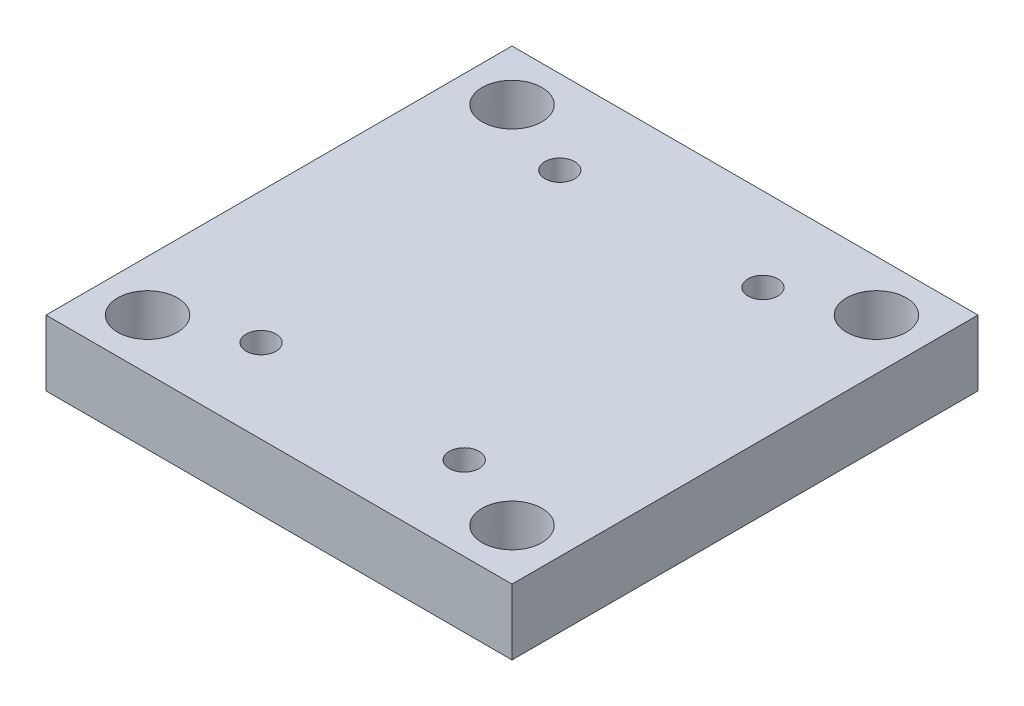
SolidWorks part; units mm, degrees
ref_plane "Plano frontal" through (0, 0, 0) normal (0, 0, 1) x (1, 0, 0)
ref_plane "Plano superior" through (0, 0, 0) normal (0, 1, 0) x (1, 0, 0)
ref_plane "Plano direito" through (0, 0, 0) normal (1, 0, 0) x (0, 0, -1)
sketch "Esboço1" plane through (0, 0, 0) normal (0, 1, 0) x (1, 0, 0)
  line L1 (-78, -78) -> (78, -78)
  line L2 (-78, -78) -> (-78, 78)
  line L3 (-78, 78) -> (78, 78)
  line L4 (78, -78) -> (78, 78)
  line L5 (-78, -78) -> (78, 78) construction
  line L6 (-78, 78) -> (78, -78) construction
  point P0 (0, 0)
  dimension "D1" = 156
  dimension "D2" = 156
extrude "Extrusão1" add sketch "Esboço1" along normal blind 22
sketch "Esboço2" plane through (0, 22, 0) normal (0, 1, 0) x (1, 0, 0)
  line L0 (-78, -78) -> (78, -78) construction
  line L3 (78, -78) -> (78, 78) construction
  circle A0 centre (61, -61) radius 10
  circle A1 centre (-61, -61) radius 10
  circle A2 centre (-61, 61) radius 10
  circle A3 centre (61, 61) radius 10
  dimension "D1" = 20
  dimension "D2" = 20
  dimension "D3" = 122
  dimension "D4" = 122
  dimension "D6" = 17
  dimension "D5" = 17
extrude "Extrusão2" cut sketch "Esboço2" against normal through all
sketch "Esboço3" plane through (0, 0, 0) normal (0, -1, 0) x (1, 0, 0)
  circle A0 centre (61, 61) radius 12.5
  circle A1 centre (-61, 61) radius 12.5
  circle A2 centre (-61, -61) radius 12.5
  circle A3 centre (61, -61) radius 12.5
  dimension "D1" = 25
extrude "Extrusão3" cut sketch "Esboço3" against normal blind 6
sketch "Esboço4" plane through (0, 0, 0) normal (0, -1, 0) x (1, 0, 0)
  line L0 (78, -78) -> (-78, -78) construction
  line L1 (78, 78) -> (78, -78) construction
  circle A0 centre (34, -50) radius 5
  circle A1 centre (-34, -50) radius 5
  circle A2 centre (34, 50) radius 5
  circle A3 centre (-34, 50) radius 5
  dimension "D1" = 10
  dimension "D2" = 28
  dimension "D3" = 44
extrude "Extrusão4" cut sketch "Esboço4" against normal through all
